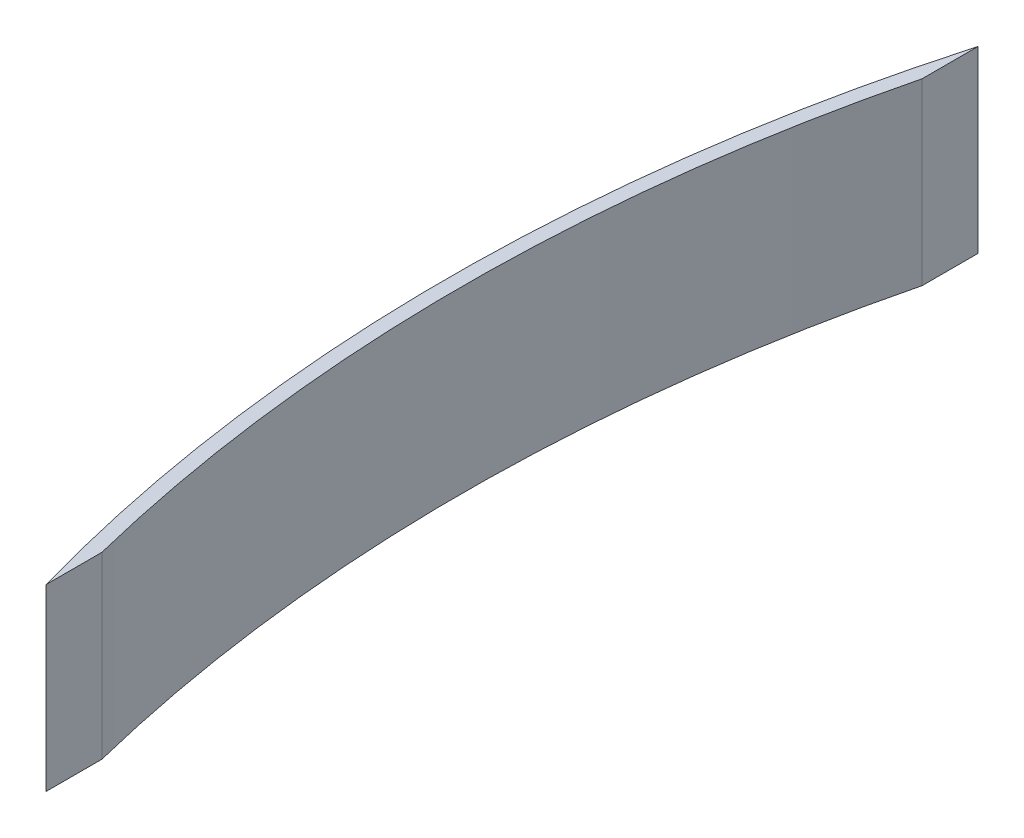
SolidWorks part; units mm, degrees
ref_plane "Piano frontale" through (0, 0, 0) normal (0, 0, 1) x (1, 0, 0)
ref_plane "Piano superiore" through (0, 0, 0) normal (0, 1, 0) x (1, 0, 0)
ref_plane "Piano destro" through (0, 0, 0) normal (1, 0, 0) x (0, 0, -1)
sketch "Schizzo1" plane through (0, 0, 0) normal (0, 1, 0) x (1, 0, 0)
  line L0 (0, 5.7202) -> (0, 0) construction
  line L1 (0, 0) -> (0, -5.7202) construction
  line L2 (-0.9, 3.9889) -> (-0.9, -6.4123) construction
  line L3 (0, 6.5) -> (0, 5.7202)
  line L4 (0, -6.5) -> (0, -5.7202)
  arc A0 (0, -6.5) -> (0, 6.5) centre (23.0222, 0) cw
  arc A1 (0, -5.7202) -> (0, 5.7202) centre (23.0222, 0) cw
  arc A3 (0.1925, -6.4457) -> (0.1925, 6.4457) centre (23.0222, 0) cw construction
  dimension "D1" = 6.5
  dimension "D2" = 6.5
  dimension "D3" = 0.2
  dimension "D4" = 0.9
extrude "Estrusione-Estrusione1" add sketch "Schizzo1" along normal blind 2.5
